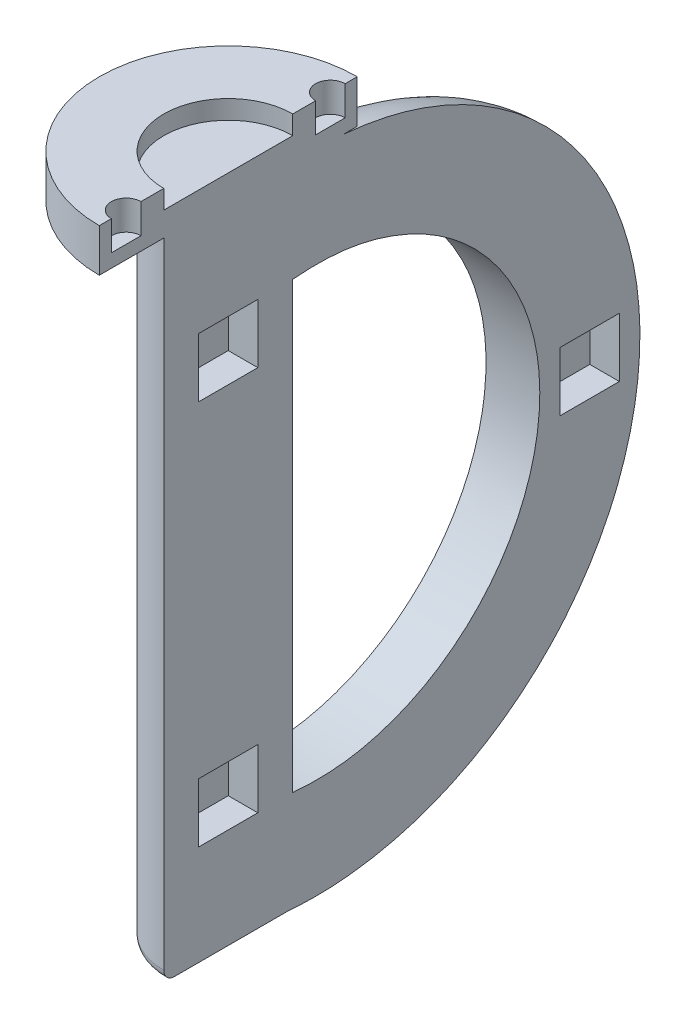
SolidWorks part; units mm, degrees
ref_plane "Front Plane" through (0, 0, 0) normal (0, 0, 1) x (1, 0, 0)
ref_plane "Top Plane" through (0, 0, 0) normal (0, 1, 0) x (1, 0, 0)
ref_plane "Right Plane" through (0, 0, 0) normal (1, 0, 0) x (0, 0, -1)
sketch "Sketch1" plane through (0, 0, 0) normal (0, 1, 0) x (1, 0, 0)
  circle A0 centre (0, 0) radius 24
  dimension "D1" = 48
extrude "Boss-Extrude1" add sketch "Sketch1" along normal blind 8
sketch "Sketch12" plane through (0, 0, 0) normal (0, 0, 1) x (1, 0, 0)
  line L0 (0, 0) -> (0, -120)
  line L1 (0, -120) -> (12, -120)
  line L2 (12, -120) -> (12, 0)
  line L3 (-24, 0) -> (24, 0) construction
  line L4 (12, 0) -> (0, 0)
  line L5 (0, 0) -> (0.3914, 0.2819)
  dimension "D1" = 12
  dimension "D2" = 120
revolve "Revolve4" add sketch "Sketch12" angle 360 about L0
sketch "Sketch13" plane through (0, 0, 0) normal (0, 0, 1) x (1, 0, 0)
  line L0 (-10, -18.6332) -> (10, -18.6332)
  arc A0 (10, -18.6332) -> (-10, -18.6332) centre (0, -12) ccw
  dimension "D1" = 24
  dimension "D2" = 20
sketch "Sketch14" plane through (0, 0, 0) normal (1, 0, 0) x (0, 0, -1)
  line L2 (0, -108) -> (12, -108)
  line L3 (0, -12) -> (12, -12)
  arc A0 (12, -108) -> (12, -12) centre (16.4021, -60) ccw
  dimension "D2" = 12
  dimension "D3" = 12
sweep "Sweep1" add profiles "Sketch13" path "Sketch14"
sketch "Sketch15" plane through (0, -120, 0) normal (0, -1, 0) x (1, 0, 0)
  line L0 (0, 0) -> (0, -90.1747)
  line L1 (0, -90.1747) -> (36.7511, -90.1747)
  line L2 (36.7511, -90.1747) -> (36.7511, 36.1347)
  line L3 (36.7511, 36.1347) -> (0, 36.1347)
  line L4 (0, 36.1347) -> (0, 0)
extrude "Cut-Extrude7" cut sketch "Sketch15" against normal through all
sketch "Sketch16" plane through (0, 0, 0) normal (1, 0, 0) x (0, 0, -1)
  line L5 (5.5, -101.3668) -> (-5.5, -101.3668)
  line L6 (5.5, -18.6332) -> (-5.5, -18.6332)
  line L8 (61.7703, -54.5) -> (61.7703, -65.5)
  line L9 (61.7703, -65.5) -> (72.7703, -65.5)
  line L10 (72.7703, -65.5) -> (72.7703, -54.5)
  line L11 (72.7703, -54.5) -> (61.7703, -54.5)
  line L12 (-5.5, -18.6332) -> (-5.5, -29.6332)
  line L13 (-5.5, -29.6332) -> (5.5, -29.6332)
  line L14 (5.5, -29.6332) -> (5.5, -18.6332)
  line L15 (-5.5, -101.3668) -> (-5.5, -90.3668)
  line L16 (-5.5, -90.3668) -> (5.5, -90.3668)
  line L17 (5.5, -90.3668) -> (5.5, -101.3668)
  dimension "D1" = 11
  dimension "D2" = 11
  dimension "D4" = 11
  dimension "D5" = 11
  dimension "D6" = 11
  dimension "D7" = 11
extrude "Cut-Extrude8" cut sketch "Sketch16" against normal blind 5.5
sketch "Sketch17" plane through (0, -120, 0) normal (0, 1, 0) x (1, 0, 0)
  line L0 (0, 21.3994) -> (0, 11.4509)
  line L1 (0, 11.4509) -> (4.8372, 11.4509)
  line L2 (4.8372, 11.4509) -> (4.8372, 21.3994)
  line L3 (4.8372, 21.3994) -> (0, 21.3994)
extrude "Cut-Extrude9" cut sketch "Sketch17" against normal blind 10
fillet "Fillet1" radius 2 1 edges at (-11.9891, -120, 0.5119)
sketch "Sketch18" plane through (0, 8, 0) normal (0, 1, 0) x (1, 0, 0)
  circle A0 centre (0, 0) radius 12
  dimension "D1" = 24
extrude "Cut-Extrude10" cut sketch "Sketch18" against normal blind 3.5
sketch "Sketch19" plane through (0, 8, 0) normal (0, 1, 0) x (1, 0, 0)
  line L0 (0, -24) -> (0, -12) construction
  line L1 (0, 12) -> (0, 24) construction
  circle A1 centre (0, 19) radius 2.75
  circle A2 centre (0, -19) radius 2.75
  dimension "D3" = 19
  dimension "D4" = 5.5
  dimension "D1" = 19
extrude "Cut-Extrude11" cut sketch "Sketch19" against normal blind 5.5
